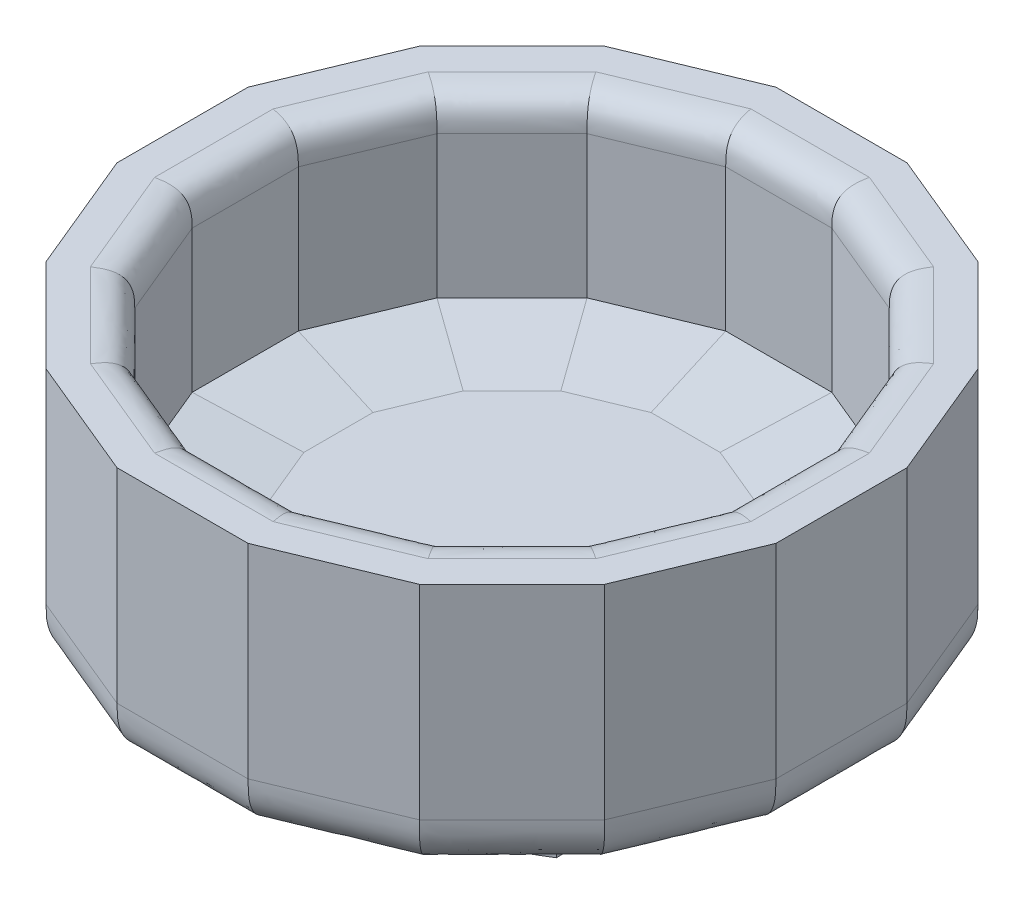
SolidWorks part; units mm, degrees
ref_plane "Front Plane" through (0, 0, 0) normal (0, 0, 1) x (1, 0, 0)
ref_plane "Top Plane" through (0, 0, 0) normal (0, 1, 0) x (1, 0, 0)
ref_plane "Right Plane" through (0, 0, 0) normal (1, 0, 0) x (0, 0, -1)
sketch "Sketch1" plane through (0, 0, 0) normal (0, 1, 0) x (1, 0, 0)
  line L0 (8.589, -43.18) -> (24.4595, -36.6062)
  line L2 (-43.18, -8.589) -> (-43.18, 8.589)
  line L4 (43.18, -8.589) -> (43.18, 8.589)
  line L5 (16.5243, -39.8931) -> (-16.5243, 39.8931) construction
  line L6 (0, 43.18) -> (0, -43.18) construction
  line L7 (8.589, 43.18) -> (-8.589, 43.18)
  line L9 (8.589, -43.18) -> (-8.589, -43.18)
  line L11 (-16.5243, -39.8931) -> (16.5243, 39.8931) construction
  line L12 (30.5329, 30.5329) -> (-30.5329, -30.5329) construction
  line L13 (24.4595, -36.6062) -> (36.6062, -24.4595)
  line L14 (36.6062, -24.4595) -> (43.18, -8.589)
  line L15 (43.18, 8.589) -> (36.6062, 24.4595)
  line L16 (36.6062, 24.4595) -> (24.4595, 36.6062)
  line L17 (24.4595, 36.6062) -> (8.589, 43.18)
  line L18 (-8.589, 43.18) -> (-24.4595, 36.6062)
  line L19 (-24.4595, 36.6062) -> (-36.6062, 24.4595)
  line L20 (-36.6062, 24.4595) -> (-43.18, 8.589)
  line L21 (-43.18, -8.589) -> (-36.6062, -24.4595)
  line L22 (-36.6062, -24.4595) -> (-24.4595, -36.6062)
  line L23 (-24.4595, -36.6062) -> (-8.589, -43.18)
  line L24 (-39.8931, -16.5243) -> (39.8931, 16.5243) construction
  line L25 (-43.18, 0) -> (43.18, 0) construction
  line L26 (-39.8931, 16.5243) -> (39.8931, -16.5243) construction
  line L27 (30.5329, -30.5329) -> (-30.5329, 30.5329) construction
  point P32 (0, 0)
  point P33 (0, 0)
  dimension "D1" = 86.36
extrude "Boss-Extrude1" add sketch "Sketch1" along normal blind 30.48
shell "Shell3" thickness 10.16
sketch "Sketch2" plane through (0, -10.16, 0) normal (0, -1, 0) x (-1, 0, 0)
  line L1 (-15.8413, 9.5072) -> (-16.1541, -8.9653)
  line L2 (-16.1541, -8.9653) -> (-0.3129, -18.4726)
  line L3 (-0.3129, -18.4726) -> (15.8413, -9.5072)
  line L4 (15.8413, -9.5072) -> (16.1541, 8.9653)
  line L5 (16.1541, 8.9653) -> (0.3129, 18.4726)
  line L6 (0.3129, 18.4726) -> (-15.8413, 9.5072)
  circle A0 centre (0, 0) radius 16 construction
  dimension "D1" = 32
extrude "Boss-Extrude2" add sketch "Sketch2" along normal blind 22.86
fillet "Fillet1" radius 3.81 6 edges at (-8.2335, -10.16, -13.7189) (-15.9977, -10.16, 0.271) (-7.7642, -10.16, 13.9899) (8.2335, -10.16, 13.7189) (15.9977, -10.16, -0.271) (7.7642, -10.16, -13.9899)
fillet "Fillet2" radius 7.62 16 edges at (37.7171, -10.16, -37.7171) (20.4123, -10.16, -49.2797) (0, -10.16, -53.34) (-20.4123, -10.16, -49.2797) (-37.7171, -10.16, -37.7171) (-49.2797, -10.16, -20.4123) (-53.34, -10.16, 0) (-49.2797, -10.16, 20.4123) (-37.7171, -10.16, 37.7171) (-20.4123, -10.16, 49.2797) (0, -10.16, 53.34) (20.4123, -10.16, 49.2797) (37.7171, -10.16, 37.7171) (49.2797, -10.16, 20.4123) (53.34, -10.16, 0) (49.2797, -10.16, -20.4123)
chamfer "Chamfer1" distance 2.38 distance2 15.08 16 edges at (43.18, 0, 0) (39.8931, 0, 16.5243) (30.5329, 0, 30.5329) (16.5243, 0, 39.8931) (0, 0, 43.18) (-16.5243, 0, 39.8931) (-30.5329, 0, 30.5329) (-39.8931, 0, 16.5243) (-43.18, 0, 0) (-39.8931, 0, -16.5243) (-30.5329, 0, -30.5329) (-16.5243, 0, -39.8931) (0, 0, -43.18) (16.5243, 0, -39.8931) (30.5329, 0, -30.5329) (39.8931, 0, -16.5243)
sketch "Sketch3" plane through (0, -10.16, 0) normal (0, -1, 0) x (-1, 0, 0)
  text T0 "328i Oil Filter" font "Century Gothic" height in points 14
extrude "Cut-Extrude1" cut sketch "Sketch3" against normal blind 1.27
fillet "Fillet3" radius 5.08 16 edges at (-16.5243, 30.48, -39.8931) (0, 30.48, -43.18) (16.5243, 30.48, -39.8931) (30.5329, 30.48, -30.5329) (39.8931, 30.48, -16.5243) (43.18, 30.48, 0) (39.8931, 30.48, 16.5243) (30.5329, 30.48, 30.5329) (16.5243, 30.48, 39.8931) (0, 30.48, 43.18) (-16.5243, 30.48, 39.8931) (-30.5329, 30.48, 30.5329) (-39.8931, 30.48, 16.5243) (-43.18, 30.48, 0) (-39.8931, 30.48, -16.5243) (-30.5329, 30.48, -30.5329)
